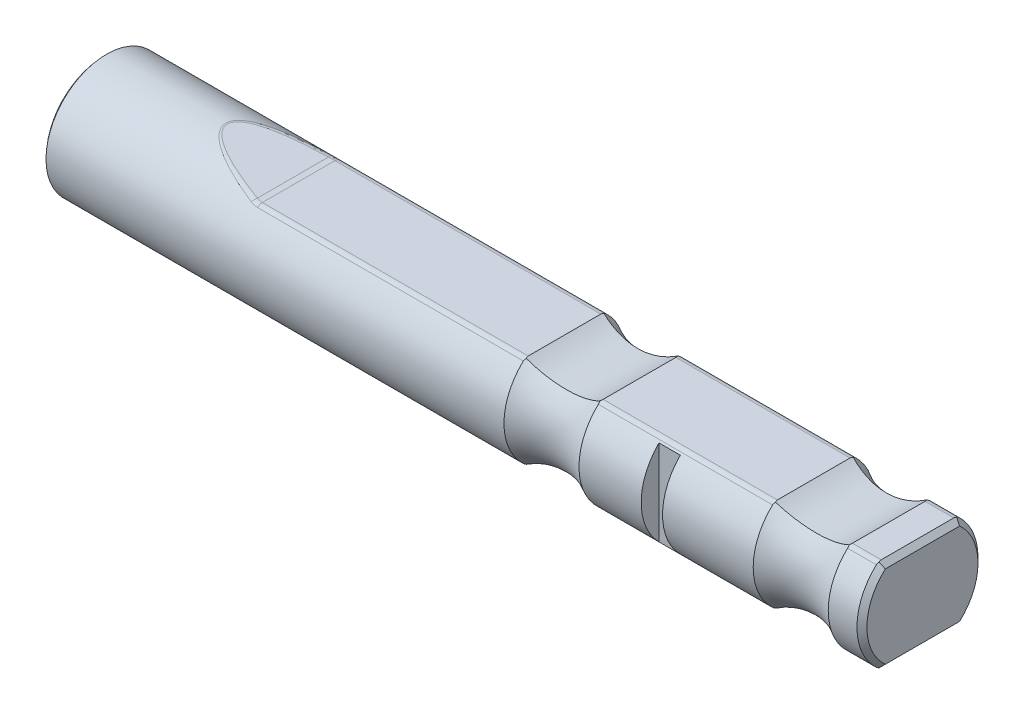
SolidWorks part; units mm, degrees
ref_plane "Plane1" through (0, 0, 0) normal (0, 0, 1) x (1, 0, 0)
ref_plane "Plane2" through (0, 0, 0) normal (0, 1, 0) x (1, 0, 0)
ref_plane "Plane3" through (0, 0, 0) normal (1, 0, 0) x (0, 0, -1)
sketch "Esquisse1" plane through (0, 0, 0) normal (0, 0, 1) x (1, 0, 0)
  line L0 (0, 8) -> (0, 4)
  line L1 (0, 4) -> (13.9257, 4)
  line L2 (13.9257, 4) -> (13.9257, 3)
  line L3 (13.9257, 3) -> (15, 3)
  line L4 (15, 3) -> (17, 0)
  line L5 (0.4257, 8.5) -> (0, 8)
  line L6 (75.2678, 8.5) -> (99.7322, 8.5)
  line L7 (115, 8.5) -> (115, 0)
  line L8 (17, 0) -> (115, 0)
  line L9 (110.2678, 8.5) -> (115, 8.5)
  line L11 (0, 0) -> (124, 0) construction
  line L12 (0.4257, 8.5) -> (64.7322, 8.5)
  arc A0 (99.7322, 8.5) -> (110.2678, 8.5) centre (105, 17) ccw
  arc A1 (64.7322, 8.5) -> (75.2678, 8.5) centre (70, 17.5) ccw
  dimension "D2" = 20
  dimension "D3" = 10
  dimension "D1" = 115
  dimension "D4" = 45
  dimension "D5" = 8.5
  dimension "D6" = 4
revolve "Base-Révolution" add sketch "Esquisse1" angle 360 about L11
ref_plane "Plan4" through (0, 0, 12) normal (0, 0, 1) x (1, 0, 0)
sketch "Esquisse2" plane through (0, 0, 12) normal (0, 0, 1) x (1, 0, 0)
  line L0 (115, -8.5) -> (115, 8.5) construction
  line L1 (208, 6.5) -> (27.4075, 6.5)
  line L2 (208, 6.5) -> (208, 12)
  line L3 (0.2857, 12) -> (208, 12)
  line L4 (26.6009, -6.5822) -> (0.2857, -12)
  line L5 (207, 0) -> (91, 0) construction
  line L6 (26.6009, 6.5822) -> (0.2857, 12)
  line L7 (0.2857, -12) -> (208, -12)
  line L8 (208, -6.5) -> (208, -12)
  line L9 (208, -6.5) -> (27.4075, -6.5)
  arc A0 (26.6009, 6.5822) -> (27.4075, 6.5) centre (27.4075, 10.5) ccw
  arc A1 (26.6009, -6.5822) -> (27.4075, -6.5) centre (27.4075, -10.5) cw
  point P11 (27, 6.5)
  dimension "D3" = 4
  dimension "D1" = 6.5
  dimension "D2" = 88
extrude "Enlèv. mat.-Extru.1" cut sketch "Esquisse2" against normal through all
chamfer "Chanfrein4" distance 0.7 angle 45
fillet "Congé2" radius 1
fillet "Congé3" radius 1
sketch "Esquisse10" plane through (0, 0, 12) normal (0, 0, 1) x (1, 0, 0)
  line L0 (72.4182, 0) -> (96.1047, 0) construction
  line L1 (114.3, 0) -> (115, 0) construction
  circle A0 centre (70, 15) radius 10
  circle A1 centre (105, 15) radius 10
  circle A2 centre (105, -15) radius 10
  circle A3 centre (70, -15) radius 10
  dimension "D1" = 20
extrude "Enlèv. mat.-Extru.8" cut sketch "Esquisse10" against normal through all
sketch "Esquisse11" plane through (0, 6.5, 0) normal (0, 1, 0) x (-1, 0, 0)
  line L0 (-87, 26) -> (-84, 26)
  line L1 (-87, 26) -> (-87, 6)
  line L2 (-84, 6) -> (-87, 6)
  line L3 (-84, 6) -> (-84, 26)
  dimension "D1" = 28
  dimension "D2" = 3
  dimension "D3" = 6
extrude "Enlèv. mat.-Extru.9" cut sketch "Esquisse11" against normal through all
